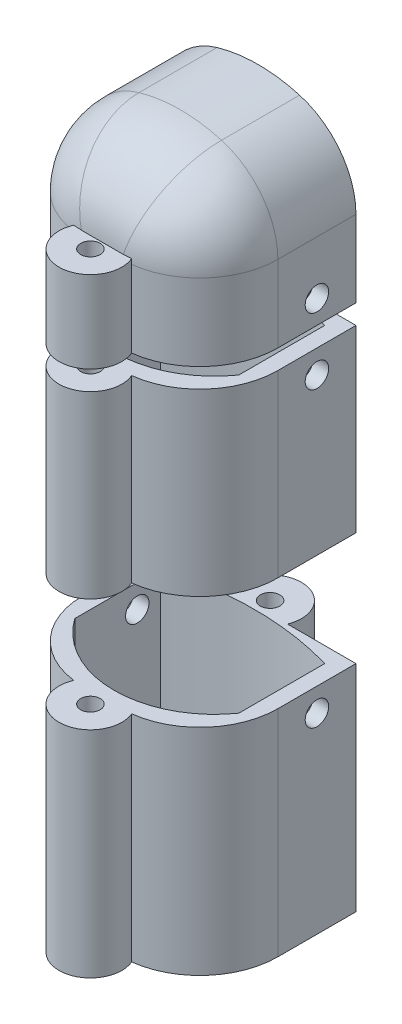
SolidWorks part; units mm, degrees
ref_plane "Alzado" through (0, 0, 0) normal (0, 0, 1) x (1, 0, 0)
ref_plane "Planta" through (0, 0, 0) normal (0, 1, 0) x (1, 0, 0)
ref_plane "Vista lateral" through (0, 0, 0) normal (1, 0, 0) x (0, 0, -1)
sketch "Croquis1" plane through (0, 0, 0) normal (0, 0, 1) x (1, 0, 0)
  line L1 (-18.6681, -47.5) -> (6.3319, -47.5)
  line L2 (-18.6681, -47.5) -> (-18.6681, 47.5)
  line L4 (6.3319, -47.5) -> (6.3319, 47.5)
  arc A0 (-18.6681, 47.5) -> (6.3319, 47.5) centre (-6.1681, 33.2195) cw
  point P0 (-2.2125, 0)
  dimension "D1" = 95
  dimension "D2" = 25
extrude "Saliente-Extruir1" add sketch "Croquis1" along normal blind 20
fillet "Redondeo1" radius 10 2 edges at (-18.6681, 47.5, 10) (6.3319, 47.5, 10)
fillet "Redondeo2" radius 10 5 edges at (-18.6681, -2.8285, 20) (-16.6633, 47.8494, 20) (-6.1681, 52.198, 20) (4.327, 47.8494, 20) (6.3319, -2.8285, 20)
sketch "Croquis2" plane through (0, 0, 20) normal (0, 0, 1) x (1, 0, 0)
  line L0 (-18.6681, 32.0235) -> (6.3319, 32.0235)
  line L4 (6.3319, 41.8429) -> (6.3319, -47.5) construction
  line L5 (-18.6681, -47.5) -> (-18.6681, 41.8429) construction
  line L7 (6.3319, 32.0235) -> (6.3319, 29.5235)
  line L8 (6.3319, 29.5235) -> (-18.6681, 29.5235)
  line L9 (-18.6681, 32.0235) -> (-18.6681, 29.5235)
  line L13 (6.3319, -5.4765) -> (-18.6681, -5.4765)
  line L14 (6.3319, -5.4765) -> (6.3319, -7.9765)
  line L15 (6.3319, -7.9765) -> (-18.6681, -7.9765)
  line L16 (-18.6681, -5.4765) -> (-18.6681, -7.9765)
  dimension "D2" = 2.5
  dimension "D4" = 2.5
extrude "Cortar-Extruir1" cut sketch "Croquis2" against normal blind 20
sketch "Croquis4" plane through (0, 0, 0) normal (0, 0, -1) x (-1, 0, 0)
  line L0 (18.6681, -47.5) -> (-6.3319, -47.5) construction
  line L2 (-4.3319, 37.5) -> (-4.3319, -47.5)
  line L3 (-4.3319, -47.5) -> (16.6681, -47.5)
  line L4 (16.6681, 37.5) -> (16.6681, -47.5)
  line L5 (-6.3319, -5.4765) -> (-6.3319, 29.5235) construction
  line L6 (18.6681, 29.5235) -> (18.6681, -5.4765) construction
  arc A0 (-4.3319, 37.5) -> (16.6681, 37.5) centre (6.1681, 39.1013) cw
  dimension "D1" = 2
  dimension "D2" = 2
  dimension "D3" = 85
extrude "Cortar-Extruir2" cut sketch "Croquis4" against normal blind 13
sketch "Croquis6" plane through (0, -47.5, 0) normal (0, -1, 0) x (1, 0, 0)
  line L0 (-8.6681, 20) -> (-3.6681, 20) construction
  line L1 (-7.6681, 21.5) -> (-8.6681, 20)
  line L2 (-4.6681, 21.5) -> (-3.6681, 20)
  line L3 (-3.6681, 20) -> (-8.6681, 20)
  line L8 (-3.6681, 0) -> (-8.6681, 0)
  line L9 (-4.6681, -1.5) -> (-3.6681, 0)
  line L10 (-7.6681, -1.5) -> (-8.6681, 0)
  arc A0 (-4.6681, 21.5) -> (-7.6681, 21.5) centre (-6.1681, 21.5) ccw
  arc A1 (6.3319, 10) -> (-3.6681, 20) centre (-3.6681, 10) ccw construction
  arc A2 (-4.6681, -1.5) -> (-7.6681, -1.5) centre (-6.1681, -1.5) cw
  dimension "D1" = 3
  dimension "D2" = 1.5
extrude "Saliente-Extruir2" add sketch "Croquis6" against normal blind 90
sketch "Croquis7" plane through (0, -47.5, 0) normal (0, -1, 0) x (1, 0, 0)
  circle A0 centre (-6.1681, 21.5) radius 1.25
  dimension "D1" = 2.5
extrude "Cortar-Extruir3" cut sketch "Croquis7" against normal blind 90
sketch "Croquis8" plane through (0, 0, 0) normal (0, 0, -1) x (-1, 0, 0)
  line L1 (-6.3319, 32.0235) -> (18.6681, 32.0235)
  line L2 (-6.3319, 32.0235) -> (-6.3319, 29.5235)
  line L3 (-6.3319, 29.5235) -> (18.6681, 29.5235)
  line L4 (18.6681, 32.0235) -> (18.6681, 29.5235)
  line L5 (-6.3319, -5.4765) -> (18.6681, -5.4765)
  line L6 (-6.3319, -5.4765) -> (-6.3319, -7.9765)
  line L7 (-6.3319, -7.9765) -> (18.6681, -7.9765)
  line L8 (18.6681, -5.4765) -> (18.6681, -7.9765)
extrude "Cortar-Extruir5" cut sketch "Croquis8" against normal through all both and the other way through all
sketch "Croquis9" plane through (6.3319, 0, 0) normal (1, 0, 0) x (0, 0, -1)
  line L0 (-5, 35.0235) -> (-5, -47.5) construction
  line L1 (-10, -47.5) -> (0, -47.5) construction
  line L2 (0, 32.0235) -> (-10, 32.0235) construction
  line L3 (0, 29.5235) -> (-10, 29.5235) construction
  line L4 (0, -5.4765) -> (-10, -5.4765) construction
  line L5 (0, -7.9765) -> (-10, -7.9765) construction
  circle A0 centre (-5, 35.0235) radius 1.5
  circle A1 centre (-5, 26.5235) radius 1.5
  circle A2 centre (-5, -2.4765) radius 1.5
  circle A3 centre (-5, -10.9765) radius 1.5
  dimension "D1" = 3
  dimension "D3" = 3
  dimension "D5" = 3
  dimension "D7" = 3
  dimension "D2" = 3
  dimension "D4" = 3
  dimension "D6" = 3
  dimension "D8" = 3
extrude "Cortar-Extruir6" cut sketch "Croquis9" against normal blind 33
sketch "Croquis11" plane through (0, 0, 0) normal (0, 0, -1) x (-1, 0, 0)
  line L0 (-6.3319, 41.8429) -> (-6.3319, 32.0235)
  line L1 (-6.3319, 32.0235) -> (18.6681, 32.0235)
  line L2 (18.6681, 32.0235) -> (18.6681, 41.8429)
  line L3 (-6.3319, 29.5235) -> (18.6681, 29.5235)
  line L4 (18.6681, 29.5235) -> (18.6681, -5.4765)
  line L5 (18.6681, -5.4765) -> (-6.3319, -5.4765)
  line L6 (-6.3319, -5.4765) -> (-6.3319, 29.5235)
  line L7 (-6.3319, -7.9765) -> (18.6681, -7.9765)
  line L8 (18.6681, -7.9765) -> (18.6681, -47.5)
  line L9 (18.6681, -47.5) -> (-6.3319, -47.5)
  line L10 (-6.3319, -47.5) -> (-6.3319, -7.9765)
  arc A0 (-6.3319, 41.8429) -> (18.6681, 41.8429) centre (6.1681, 39.4758) cw
extrude "Saliente-Extruir3" add sketch "Croquis11" against normal blind 2
sketch "Croquis12" plane through (0, -47.5, 0) normal (0, -1, 0) x (1, 0, 0)
  line L0 (4.3319, 2) -> (-16.6681, 2) construction
  line L1 (-16.6681, 2) -> (4.3319, 2)
  arc A0 (-16.6681, 2) -> (4.3319, 2) centre (-6.1681, 37.7609) ccw
extrude "Cortar-Extruir7" cut sketch "Croquis12" against normal blind 91
sketch "Croquis13" plane through (0, -47.5, 0) normal (0, -1, 0) x (1, 0, 0)
  line L0 (-16.6681, 13) -> (4.3319, 13)
  arc A0 (-16.6681, 13) -> (4.3319, 13) centre (-6.1681, 5.6243) cw
extrude "Cortar-Extruir8" cut sketch "Croquis13" against normal blind 94
sketch "Croquis15" plane through (0, 42.5, 0) normal (0, 1, 0) x (1, 0, 0)
  circle A0 centre (-6.1681, 1.5) radius 1.25
  dimension "D1" = 2.5
extrude "Cortar-Extruir9" cut sketch "Croquis15" against normal blind 90
sketch "Croquis16" plane through (0, -47.5, 0) normal (0, -1, 0) x (1, 0, 0)
  circle A0 centre (-6.1681, -1.5) radius 1.25
  dimension "D1" = 2.5
extrude "Cortar-Extruir10" cut sketch "Croquis16" against normal blind 90
sketch "Croquis17" plane through (0, 0, 0) normal (0, 0, 1) x (1, 0, 0)
  line L0 (-18.6681, -5.4765) -> (-18.6681, 29.5235) construction
  line L1 (-18.6681, 6.5235) -> (6.3319, 6.5235)
  line L2 (-18.6681, 6.5235) -> (-18.6681, -5.4765)
  line L3 (-18.6681, -5.4765) -> (6.3319, -5.4765)
  line L4 (6.3319, 6.5235) -> (6.3319, -5.4765)
  line L5 (-18.6681, -47.5) -> (-18.6681, -7.9765) construction
  line L6 (-18.6681, -35.5) -> (6.3319, -35.5)
  line L7 (-18.6681, -35.5) -> (-18.6681, -47.5)
  line L8 (-18.6681, -47.5) -> (6.3319, -47.5)
  line L9 (6.3319, -35.5) -> (6.3319, -47.5)
  line L10 (6.3319, -7.9765) -> (6.3319, -47.5) construction
  line L11 (-3.6681, -47.5) -> (6.3319, -47.5) construction
  dimension "D1" = 12
  dimension "D2" = 12
extrude "Cortar-Extruir11" cut sketch "Croquis17" against normal through all both and the other way through all
sketch "Croquis19" plane through (0, 46.5, 0) normal (0, -1, 0) x (1, 0, 0)
  line L0 (-16.6681, 13) -> (4.3319, 13)
  arc A0 (-16.6681, 13) -> (4.3319, 13) centre (-6.1681, 5.6243) cw
extrude "Saliente-Extruir4" add sketch "Croquis19" along normal blind 14.5
sketch "Croquis20" plane through (0, -35.5, 0) normal (0, -1, 0) x (1, 0, 0)
  line L0 (-8.6681, 20) -> (-9.8731, 19.9271)
  line L1 (-3.6681, 20) -> (-2.4631, 19.9271)
  line L2 (-8.6681, 20) -> (-7.6681, 21.5)
  line L3 (-4.6681, 21.5) -> (-3.6681, 20)
  line L6 (-8.6681, 0) -> (-9.8731, 0.0729)
  line L7 (-8.6681, 0) -> (-7.6681, -1.5)
  line L8 (-4.6681, -1.5) -> (-3.6681, 0)
  line L9 (-3.6681, 0) -> (-2.4631, 0.0729)
  arc A0 (-2.4631, 19.9271) -> (-9.8731, 19.9271) centre (-6.1681, 21.5) ccw
  arc A1 (-8.6681, 20) -> (-18.6681, 10) centre (-8.6681, 10) ccw construction
  arc A2 (6.3319, 10) -> (-3.6681, 20) centre (-3.6681, 10) ccw construction
  arc A3 (-7.6681, 21.5) -> (-4.6681, 21.5) centre (-6.1681, 21.5) cw
  arc A4 (-2.4631, 0.0729) -> (-9.8731, 0.0729) centre (-6.1681, -1.5) cw
  arc A5 (-7.6681, -1.5) -> (-4.6681, -1.5) centre (-6.1681, -1.5) ccw
extrude "Saliente-Extruir5" add sketch "Croquis20" against normal blind 78
sketch "Croquis21" plane through (0, 0, 0) normal (0, 0, -1) x (-1, 0, 0)
  line L1 (-6.3319, 6.5235) -> (18.6681, 6.5235)
  line L2 (-6.3319, 6.5235) -> (-6.3319, -7.9765)
  line L3 (-6.3319, -7.9765) -> (18.6681, -7.9765)
  line L4 (18.6681, 6.5235) -> (18.6681, -7.9765)
  line L5 (-6.3319, 32.0235) -> (18.6681, 32.0235)
  line L6 (-6.3319, 32.0235) -> (-6.3319, 29.5235)
  line L7 (-6.3319, 29.5235) -> (18.6681, 29.5235)
  line L8 (18.6681, 32.0235) -> (18.6681, 29.5235)
extrude "Cortar-Extruir12" cut sketch "Croquis21" against normal through all both and the other way through all
